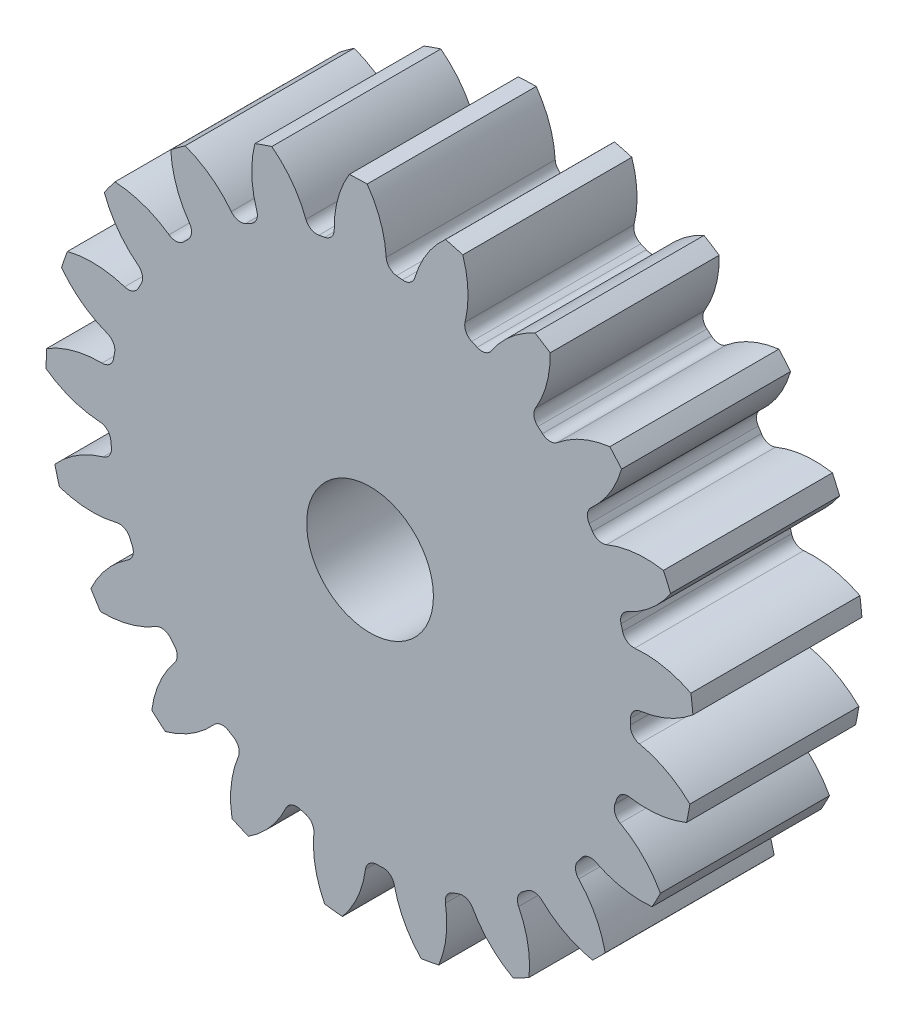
SolidWorks part; units mm, degrees
ref_plane "Front" through (0, 0, 0) normal (0, 0, 1) x (1, 0, 0)
ref_plane "Top" through (0, 0, 0) normal (0, 1, 0) x (1, 0, 0)
ref_plane "Right" through (0, 0, 0) normal (1, 0, 0) x (0, 0, -1)
sketch "Sketch3" plane through (0, 0, 0) normal (0, 0, 1) x (1, 0, 0)
  circle A0 centre (0, 0) radius 194.7333
  dimension "od" = 389.4667
extrude "gearBody" add sketch "Sketch3" along normal blind 101.6
sketch "Sketch2" plane through (0, 0, 0) normal (0, 0, 1) x (1, 0, 0)
  line L0 (0, 0) -> (154.3593, 63.9377) construction
  line L1 (192.875, -31.6884) -> (0, 0) construction
  line L2 (0, 0) -> (36.3143, 0) construction
  line L3 (177.6826, 6.4611) -> (176.6683, -20.0285) construction
  line L5 (177.1755, -6.7837) -> (0, 0) construction
  line L7 (0, 0) -> (167.0773, 0) construction
  arc A0 (167.0463, 3.2206) -> (166.311, -15.9841) centre (0, 0) ccw construction
  arc A1 (194.0523, 16.2722) -> (192.2399, -31.0625) centre (0, 0) ccw construction
  arc A2 (177.6826, 6.4611) -> (176.6683, -20.0285) centre (0, 0) ccw construction
  arc A3 (156.4394, -7.791) -> (156.5772, -4.1937) centre (0, 0) ccw
  arc A4 (192.875, -31.6884) -> (161.8924, -14.8756) centre (149.0185, -75.5534) ccw
  arc A5 (192.875, -31.6884) -> (194.7333, 16.8477) centre (0, 0) ccw
  arc A6 (194.7333, 16.8477) -> (162.5559, 2.4532) centre (154.3593, 63.9377) cw
  arc A7 (156.5772, -4.1937) -> (162.5559, 2.4532) centre (163.4666, -4.3783) cw
  arc A8 (161.8924, -14.8756) -> (156.4394, -7.791) centre (163.3228, -8.1338) cw
  point P6 (194.7333, 16.8477)
  point P22 (192.875, -31.6884)
  dimension "baseDia" = 334.1547
  dimension "od" = 389.4667
  dimension "pd" = 355.6
  dimension "rd" = 313.2667
  dimension "rFillet" = 6.8919
  dimension "pointX" = 194.7333
  dimension "pointY" = 16.8477
  dimension "CTT" = 26.4896
  dimension "flankCenterAngle" = 22.5
extrude "toothCut" cut sketch "Sketch2" along normal through all
pattern_circular "CirPattern1" count 21 over 360 about axis through (0, 0, 0) along (0, 0, 1) of "toothCut"
sketch "hub1Dia" plane through (0, 0, 0) normal (0, 0, -1) x (-1, 0, 0)
  circle A0 centre (0, 0) radius 12.7
  dimension "hub1Dia" = 25.4
sketch "hub2Dia" plane through (0, 0, 101.6) normal (0, 0, 1) x (1, 0, 0)
  circle A0 centre (0, 0) radius 12.7
  dimension "hub2dia" = 25.4
sketch "boreDia" plane through (0, 0, 0) normal (0, 0, 1) x (1, 0, 0)
  circle A0 centre (0, 0) radius 38.1
  dimension "boreDia" = 76.2
extrude "bore" cut sketch "boreDia" against normal mid plane 25400
